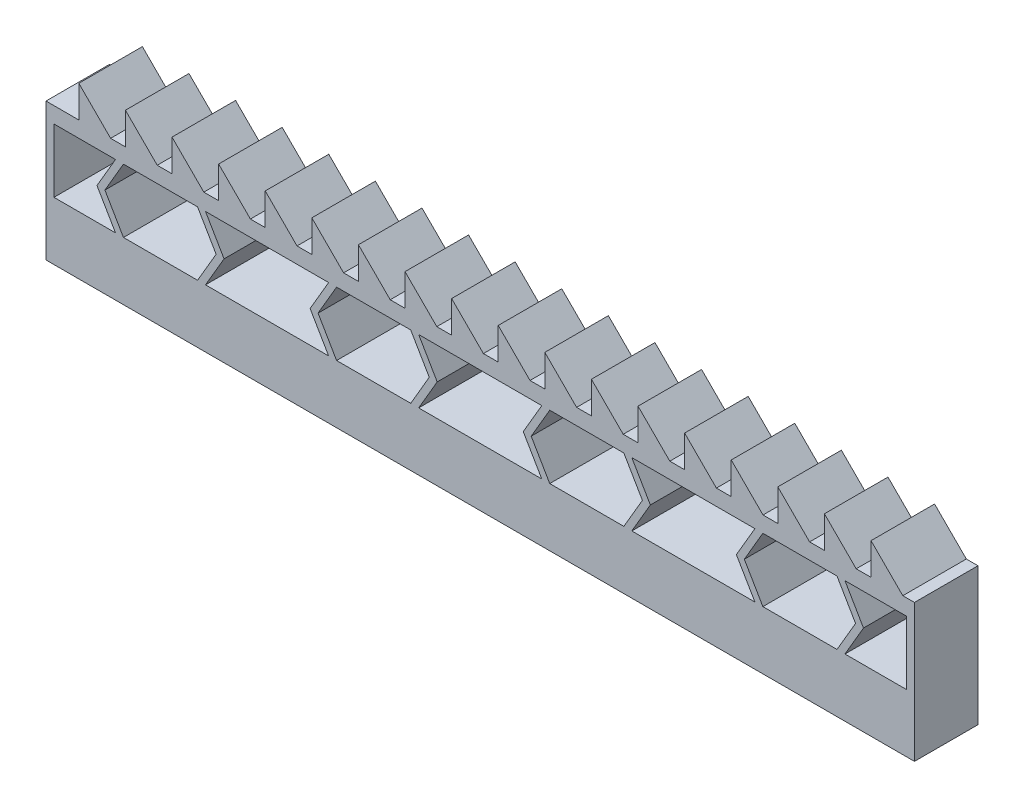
SolidWorks part; units mm, degrees
ref_plane "Front Plane" through (0, 0, 0) normal (0, 0, 1) x (1, 0, 0)
ref_plane "Top Plane" through (0, 0, 0) normal (0, 1, 0) x (1, 0, 0)
ref_plane "Right Plane" through (0, 0, 0) normal (1, 0, 0) x (0, 0, -1)
sketch "Sketch1" plane through (0, 0, 0) normal (0, 1, 0) x (1, 0, 0)
  line L1 (0, 0) -> (82, 0)
  line L2 (0, 0) -> (0, 6)
  line L3 (0, 6) -> (82, 6)
  line L4 (82, 0) -> (82, 6)
  dimension "D1" = 82
  dimension "D2" = 6
extrude "Boss-Extrude1" add sketch "Sketch1" along normal blind 13
sketch "Sketch3" plane through (0, 0, 0) normal (-1, 0, 0) x (0, 0, 1)
  line L0 (-3, 0) -> (-3, 13) construction
  line L1 (-6, 0) -> (0, 0) construction
  line L2 (-6, 13) -> (0, 13) construction
  line L3 (-4, 0) -> (-2, 0)
  line L4 (-2, 0) -> (-2, 1.8)
  line L5 (-2, 1.8) -> (-0.6, 1.8)
  line L6 (-0.6, 1.8) -> (-0.6, 3.7)
  line L7 (-0.6, 3.7) -> (-5.4, 3.7)
  line L8 (-4, 0) -> (-4, 1.8)
  line L9 (-4, 1.8) -> (-5.4, 1.8)
  line L10 (-5.4, 1.8) -> (-5.4, 3.7)
  point P15 (-3, 3.7)
  dimension "D1" = 1
  dimension "D2" = 3.7
  dimension "D3" = 1.9
  dimension "D4" = 4.8
extrude "Cut-Extrude1" cut sketch "Sketch3" against normal through all
sketch "Sketch4" plane through (0, 3.7, 0) normal (0, -1, 0) x (1, 0, 0)
  line L0 (82, -0.6) -> (0, -0.6) construction
  line L1 (0, -5.4) -> (1.4, -5.4)
  line L2 (0, -5.4) -> (0, -0.6)
  line L3 (0, -0.6) -> (1.4, -0.6)
  line L4 (1.4, -5.4) -> (1.4, -0.6)
  line L5 (82, -5.4) -> (0, -5.4) construction
  line L6 (82, -0.6) -> (80.6, -0.6)
  line L7 (82, -0.6) -> (82, -5.4)
  line L8 (82, -5.4) -> (80.6, -5.4)
  line L9 (80.6, -0.6) -> (80.6, -5.4)
  dimension "D1" = 1.4
extrude "Boss-Extrude2" add sketch "Sketch4" along normal blind 1.9
sketch "Sketch5" plane through (0, 0, 0) normal (0, -1, 0) x (1, 0, 0)
  line L0 (82, -4) -> (0, -4) construction
  line L1 (82, -2) -> (79.1, -2)
  line L2 (82, -2) -> (82, -4)
  line L3 (82, -4) -> (79.1, -4)
  line L4 (79.1, -2) -> (79.1, -4)
  line L6 (0, -2) -> (2.9, -2)
  line L7 (0, -2) -> (0, -4)
  line L8 (0, -4) -> (2.9, -4)
  line L9 (2.9, -2) -> (2.9, -4)
  dimension "D1" = 2.9
extrude "Boss-Extrude3" add sketch "Sketch5" against normal blind 2.1
sketch "Sketch6" plane through (0, 0, 0) normal (0, 0, 1) x (1, 0, 0)
  line L0 (10.8125, 11.5) -> (10.8125, 5.5) construction
  line L1 (0, 13) -> (0, 0) construction
  line L9 (0, 5) -> (82, 5) construction
  line L10 (82, 13) -> (82, 0) construction
  line L11 (6.5625, 5.5) -> (4.8125, 8.5)
  line L101 (0.75, 5.5) -> (20.875, 5.5) construction
  line L102 (0.75, 5.5) -> (0.75, 11.5) construction
  line L103 (0.75, 11.5) -> (20.875, 11.5) construction
  line L104 (20.875, 5.5) -> (20.875, 11.5) construction
  line L105 (16.0625, 8.5) -> (14.3125, 11.5)
  line L106 (14.3125, 11.5) -> (7.3125, 11.5)
  line L107 (7.3125, 11.5) -> (5.5625, 8.5)
  line L108 (5.5625, 8.5) -> (7.3125, 5.5)
  line L109 (7.3125, 5.5) -> (14.3125, 5.5)
  line L110 (14.3125, 5.5) -> (16.0625, 8.5)
  line L111 (4.8125, 8.5) -> (6.5625, 11.5)
  line L112 (6.5625, 11.5) -> (0.75, 11.5)
  line L113 (0.75, 11.5) -> (0.75, 5.5)
  line L114 (0.75, 5.5) -> (6.5625, 5.5)
  line L115 (20.875, 11.5) -> (20.875, 5.5)
  line L116 (15.0625, 11.5) -> (20.875, 11.5)
  line L117 (16.8125, 8.5) -> (15.0625, 11.5)
  line L118 (15.0625, 5.5) -> (16.8125, 8.5)
  line L119 (20.875, 5.5) -> (15.0625, 5.5)
  point P22 (10.8125, 11.5)
  dimension "D1" = 5
  dimension "D2" = 0.5
  dimension "D3" = 1.5
  dimension "D4" = 0.75
  dimension "D5" = 20.125
  dimension "D6" = 0.75
  dimension "D7" = 0.75
  dimension "D8" = 7
  dimension "D9" = 10.5
sketch "Sketch7" plane through (0, 0, 0) normal (0, 0, 1) x (1, 0, 0)
  line L0 (3.1, 13) -> (3.1, 16)
  line L1 (3.1, 16) -> (6.1, 13)
  line L2 (0, 13) -> (82, 13) construction
  line L3 (6.1, 13) -> (3.1, 13)
  line L4 (6.1, 13) -> (7.5, 13) construction
  line L5 (0, 13) -> (0, 0) construction
  dimension "D1" = 4.4
  dimension "D2" = 3
  dimension "D3" = 3
  dimension "D4" = 3.1
extrude "Boss-Extrude5" add sketch "Sketch7" against normal blind 6
pattern_linear "LPattern2" count 18 spacing 4.4 along (1, 0, 0) of "Boss-Extrude5"
extrude "Cut-Extrude2" cut sketch "Sketch6" against normal blind 6
pattern_linear "LPattern3" count 4 spacing 20.125 along (1, 0, 0) of "Cut-Extrude2"
fillet "Fillet1" radius 0.5 4 edges at (79.1, 0, -3) (41, 0, -2) (41, 0, -4) (2.9, 0, -3)
